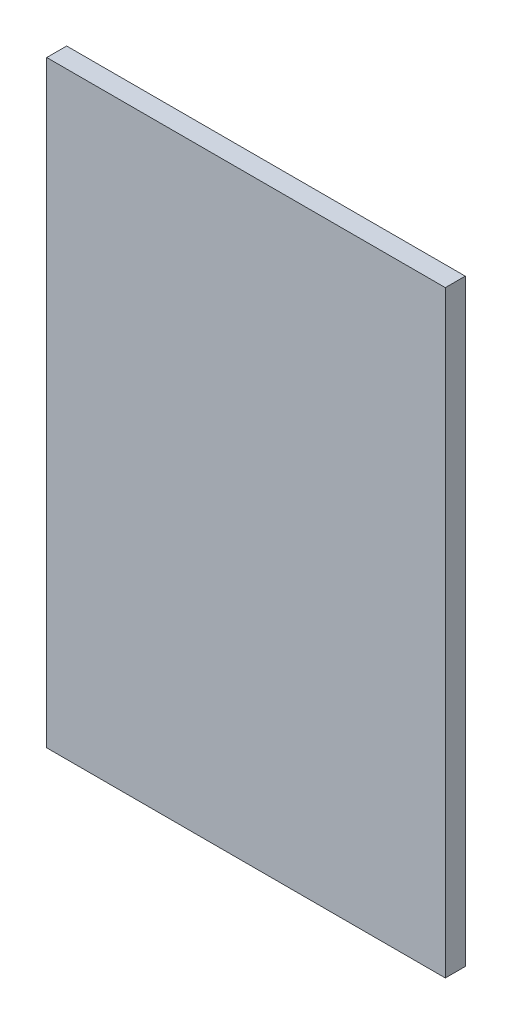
SolidWorks part; units mm, degrees
ref_plane "Płaszczyzna przednia" through (0, 0, 0) normal (0, 0, 1) x (1, 0, 0)
ref_plane "Płaszczyzna górna" through (0, 0, 0) normal (0, 1, 0) x (1, 0, 0)
ref_plane "Płaszczyzna prawa" through (0, 0, 0) normal (1, 0, 0) x (0, 0, -1)
sketch "Szkic1" plane through (0, 0, 0) normal (0, 0, 1) x (1, 0, 0)
  line L1 (0, 0) -> (100, 0)
  line L2 (0, 0) -> (0, 150)
  line L3 (0, 150) -> (100, 150)
  line L4 (100, 0) -> (100, 150)
  dimension "D1" = 100
  dimension "D2" = 150
extrude "Dodanie-wyciągnięcie1" add sketch "Szkic1" along normal blind 5
